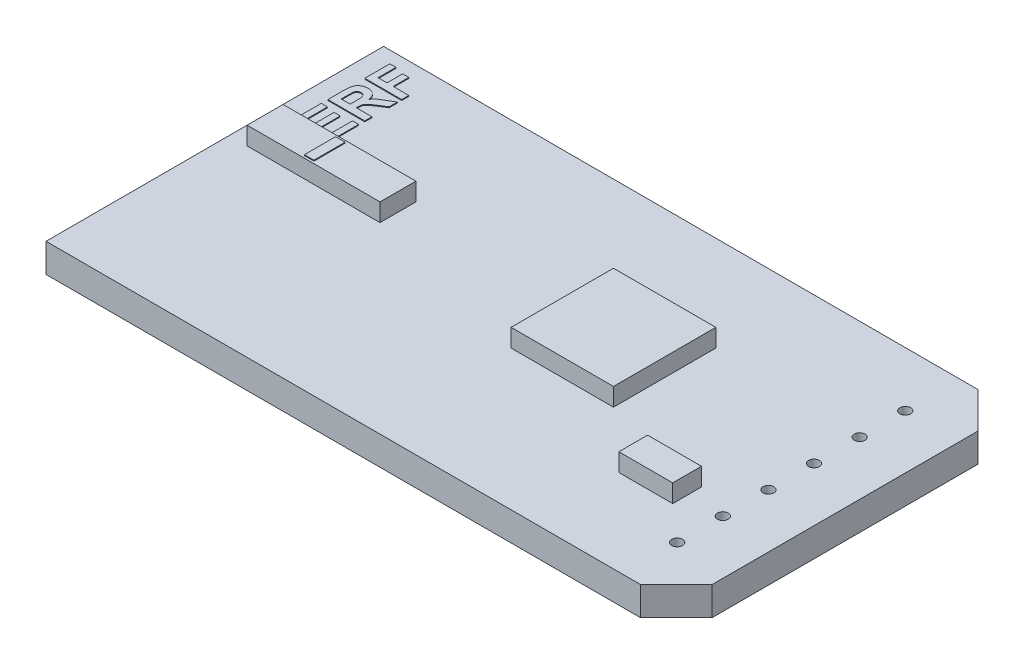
SolidWorks part; units mm, degrees
ref_plane "Plan de face" through (0, 0, 0) normal (0, 0, 1) x (1, 0, 0)
ref_plane "Plan de dessus" through (0, 0, 0) normal (0, 1, 0) x (1, 0, 0)
ref_plane "Plan de droite" through (0, 0, 0) normal (1, 0, 0) x (0, 0, -1)
sketch "Esquisse1" plane through (0, 0, 0) normal (0, 1, 0) x (1, 0, 0)
  line L0 (-7.8285, 0) -> (55.7779, 0) construction
  line L1 (0, -5.5044) -> (0, 35.3414) construction
  line L2 (-7.8285, 18.8) -> (55.7779, 18.8) construction
  line L3 (35.1, -5.5044) -> (35.1, 35.3414) construction
  line L4 (47.3702, 9.4) -> (-3.2121, 9.4) construction
  line L5 (0, 18.8) -> (33.1, 18.8)
  line L6 (0, 18.8) -> (0, 0)
  line L7 (0, 0) -> (33.1, 0)
  line L8 (35.1, 16.8) -> (35.1, 2)
  line L9 (40.4275, 16.8) -> (33.9256, 16.8) construction
  line L10 (33.1, 18.0441) -> (33.1, 25.648) construction
  line L11 (33.1, 18.8) -> (35.1, 16.8)
  line L12 (33.1, 0) -> (35.1, 2)
  line L13 (37.5623, 10.67) -> (31.0313, 10.67) construction
  line L14 (32.1, 7.7403) -> (32.1, 16.0054) construction
  circle A0 centre (32.1, 10.67) radius 0.3
  circle A1 centre (32.1, 13.21) radius 0.3
  circle A2 centre (32.1, 15.75) radius 0.3
  circle A3 centre (32.1, 3.05) radius 0.3
  circle A4 centre (32.1, 5.59) radius 0.3
  circle A5 centre (32.1, 8.13) radius 0.3
  dimension "D8" = 3
  dimension "D1" = 18.8
  dimension "D2" = 35.1
  dimension "D3" = 9.4
  dimension "D4" = 2
  dimension "D5" = 2
  dimension "D6" = 1.27
  dimension "D7" = 3
extrude "Boss.-Extru.1" add sketch "Esquisse1" along normal blind 1.6
sketch "Esquisse2" plane through (0, 1.6, 0) normal (0, 1, 0) x (1, 0, 0)
  line L0 (18.1, 23.8618) -> (18.1, 5.7632) construction
  line L1 (9.5934, 7.8) -> (29.3653, 7.8) construction
  line L2 (35.1, 2) -> (35.1, 16.8) construction
  line L3 (33.1, 18.8) -> (0, 18.8) construction
  line L4 (27.1, -2.9788) -> (27.1, 6.8901) construction
  line L5 (18.1, 7.8) -> (23.8, 7.8)
  line L6 (18.1, 7.8) -> (18.1, 13.5)
  line L7 (18.1, 13.5) -> (23.8, 13.5)
  line L8 (23.8, 7.8) -> (23.8, 13.5)
  line L9 (37.5951, 4.8) -> (25.4041, 4.8) construction
  line L11 (27.1, 4.8) -> (30.1, 4.8)
  line L12 (27.1, 4.8) -> (27.1, 6.4)
  line L13 (27.1, 6.4) -> (30.1, 6.4)
  line L14 (30.1, 4.8) -> (30.1, 6.4)
  dimension "D1" = 17
  dimension "D2" = 11
  dimension "D3" = 14
  dimension "D4" = 8
extrude "Boss.-Extru.2" add sketch "Esquisse2" along normal blind 1
sketch "Esquisse3" plane through (0, 1.6, 0) normal (0, 1, 0) x (1, 0, 0)
  line L0 (-1.6938, 10.2) -> (9.1436, 10.2) construction
  line L1 (-1.6938, 12.2) -> (9.1436, 12.2) construction
  line L2 (8.4, 8.391) -> (8.4, 21.6692) construction
  line L3 (33.1, 18.8) -> (0, 18.8) construction
  line L4 (0, 18.8) -> (0, 0) construction
  line L6 (8.4, 10.2) -> (1, 10.2)
  line L7 (8.4, 10.2) -> (8.4, 12.2)
  line L8 (8.4, 12.2) -> (1, 12.2)
  line L9 (1, 10.2) -> (1, 12.2)
  dimension "D1" = 8.6
  dimension "D2" = 2
  dimension "D3" = 8.4
extrude "Boss.-Extru.5" add sketch "Esquisse3" along normal blind 1
sketch "Esquisse5" plane through (0, 1.6, 0) normal (0, 1, 0) x (1, 0, 0)
  line L0 (3.1178, 12.5281) -> (3.1178, 20.5769) construction
  text T0 "ERF" font "Arial" height in points 8
extrude "Boss.-Extru.4" add sketch "Esquisse5" along normal blind 0.05
sketch "Esquisse6" plane through (0, 2.6, 0) normal (0, 1, 0) x (1, 0, 0)
  line L1 (4.067, 12.0573) -> (4.5965, 12.0573)
  line L2 (4.067, 12.0573) -> (4.067, 10.3254)
  line L3 (4.067, 10.3254) -> (4.5965, 10.3254)
  line L4 (4.5965, 12.0573) -> (4.5965, 10.3254)
extrude "Boss.-Extru.6" add sketch "Esquisse6" along normal blind 0.05
